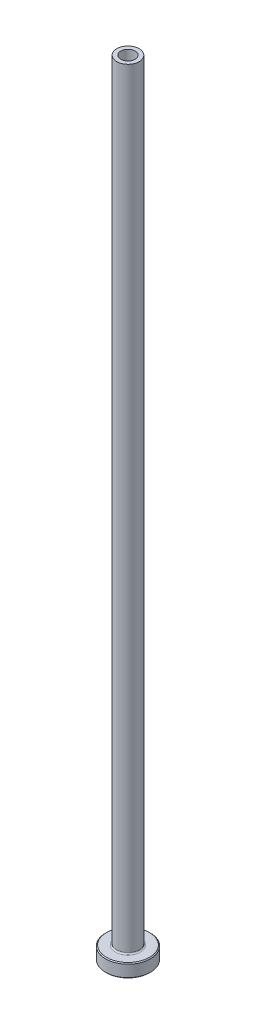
SolidWorks part; units mm, degrees
ref_plane "Front Plane" through (0, 0, 0) normal (0, 0, 1) x (1, 0, 0)
ref_plane "Top Plane" through (0, 0, 0) normal (0, 1, 0) x (1, 0, 0)
ref_plane "Right Plane" through (0, 0, 0) normal (1, 0, 0) x (0, 0, -1)
sketch "Sketch1" plane through (0, 0, 0) normal (0, 0, 1) x (1, 0, 0)
  line L0 (-1.6, 175) -> (-2.5, 175)
  line L1 (-2.5, 175) -> (-2.5, 3)
  line L2 (-2.5, 3) -> (-5, 3)
  line L3 (-5, 3) -> (-5, 0)
  line L4 (5.5, 0) -> (-5.5, 0) construction
  line L5 (-5, 0) -> (-1.85, 0)
  line L6 (-1.6, 130) -> (-1.6, 175)
  line L7 (0, 92.1877) -> (0, -15.5353) construction
  line L8 (0, -5.5) -> (0, 5.5) construction
  line L9 (-1.6, 130) -> (-1.85, 118)
  line L10 (-1.85, 118) -> (-1.85, 0)
  dimension "D1" = 0.25
  dimension "ID" = 3.2
  dimension "OD" = 5
  dimension "L" = 175
  dimension "H" = 10
  dimension "T" = 3
  dimension "N" = 45
  dimension "D2" = 12
revolve "Revolve1" add sketch "Sketch1" angle 360 about L7
fillet "Fillet1" radius 0.3 1 edges at (0, 3, 2.5)
chamfer "Chamfer1" distance 0.2 angle 45 2 edges at (0, 3, 5) (0, 0, 5)
chamfer "Chamfer3" distance 0.5 angle 45 1 edges at (0, 0, 1.85)
